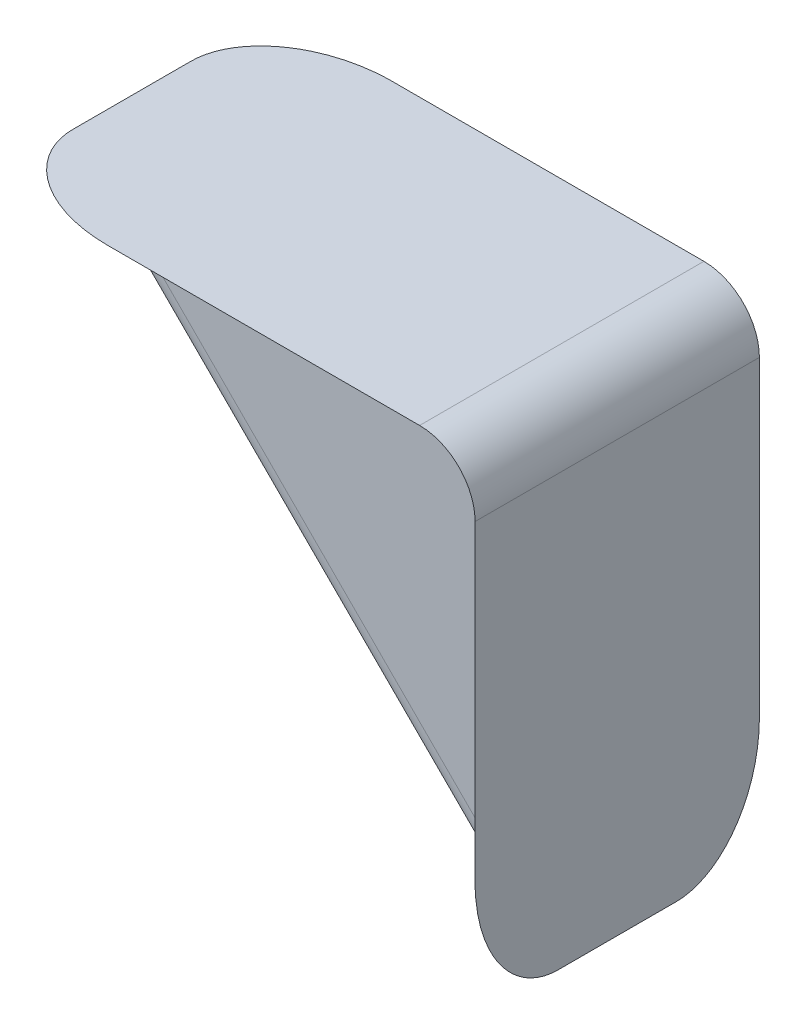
SolidWorks part; units mm, degrees
ref_plane "Plane1" through (0, 0, 0) normal (0, 0, 1) x (1, 0, 0)
ref_plane "Plane2" through (0, 0, 0) normal (0, 1, 0) x (1, 0, 0)
ref_plane "Plane3" through (0, 0, 0) normal (1, 0, 0) x (0, 0, -1)
sketch "Sketch1" plane through (0, 0, 0) normal (0, 0, 1) x (1, 0, 0)
  line L0 (-25.4, 0) -> (0, -25.4)
  line L1 (0, 0) -> (-25.4, 0)
  line L2 (0, 0) -> (0, -25.4)
  dimension "D1" = 25.4
  dimension "D2" = 45
extrude "Extrude1" add sketch "Sketch1" along normal mid plane 9.525
sketch "Sketch2" plane through (0, 0, 0) normal (0, 0, 1) x (1, 0, 0)
  line L0 (0, -25.4) -> (0, 0) construction
  line L1 (0, 0) -> (-25.4, 0) construction
  line L2 (0, -33.6549) -> (0, 0)
  line L3 (0, 0) -> (-33.0172, 0)
extrude "Extrude-Thin1" add sketch "Sketch2" along normal mid plane 26.924 thin
fillet "Fillet1" radius 1.524 2 edges at (-12.7, -12.7, -4.7625) (-12.7, -12.7, 4.7625)
fillet "Fillet2" radius 3.048 12 edges at (-0.8927, -0.8927, 4.7625) (0, -13.1464, 4.7625) (0, -24.7687, 4.3161) (0, -25.4, 0) (0, -24.7687, -4.3161) (0, -13.1464, -4.7625) (-0.8927, -0.8927, -4.7625) (-13.1464, 0, -4.7625) (-24.7687, 0, -4.3161) (-25.4, 0, 0) (-24.7687, 0, 4.3161) (-13.1464, 0, 4.7625)
sketch "Sketch3" plane through (0, 0, 13.462) normal (0, 0, 1) x (1, 0, 0)
  line L6 (-3.048, 2.54) -> (-33.0172, 2.54)
  line L7 (-33.0172, 2.54) -> (-33.0172, 0)
  line L8 (-33.0172, 0) -> (-3.048, 0)
  line L9 (0, -3.048) -> (0, -33.6549)
  line L10 (0, -33.6549) -> (2.54, -33.6549)
  line L11 (2.54, -33.6549) -> (2.54, -3.048)
  line L12 (-3.048, 2.54) -> (-33.0172, 2.54)
  line L13 (-33.0172, 2.54) -> (-33.0172, 0)
  line L14 (-33.0172, 0) -> (-3.048, 0)
  line L15 (0, -3.048) -> (0, -33.6549)
  line L16 (0, -33.6549) -> (2.54, -33.6549)
  line L17 (2.54, -33.6549) -> (2.54, -3.048)
  arc A2 (0, -3.048) -> (-3.048, 0) centre (-3.048, -3.048) ccw
  arc A3 (2.54, -3.048) -> (-3.048, 2.54) centre (-3.048, -3.048) ccw
  arc A4 (0, -3.048) -> (-3.048, 0) centre (-3.048, -3.048) ccw
  arc A5 (2.54, -3.048) -> (-3.048, 2.54) centre (-3.048, -3.048) ccw
  dimension "D1" = 0
extrude "Extrude2" cut sketch "Sketch3" against normal through all
sketch "Orientation Sketch" plane through (0, 0, 0) normal (0, 1, 0) x (1, 0, 0)
  line L4 (-3.048, 7.8105) -> (-20.1967, 7.8105) construction
  line L5 (-26.6625, 3.2385) -> (-26.6625, -3.2385) construction
  line L6 (-20.1967, -7.8105) -> (-3.048, -7.8105) construction
  line L7 (-3.048, 7.8105) -> (-3.048, -7.8105) construction
  line L8 (-3.048, 7.8105) -> (-20.1967, 7.8105)
  line L9 (-26.6625, 3.2385) -> (-26.6625, -3.2385)
  line L10 (-20.1967, -7.8105) -> (-3.048, -7.8105)
  line L11 (-3.048, 7.8105) -> (-3.048, -7.8105)
  ellipse E2 centre (-20.1967, 3.2385) end of major axis (-26.6625, 3.2385) minor radius 4.572 (-20.1967, 7.8105) -> (-26.6625, 3.2385) ccw construction
  ellipse E3 centre (-20.1967, -3.2385) end of major axis (-13.731, -3.2385) minor radius 4.572 (-26.6625, -3.2385) -> (-20.1967, -7.8105) ccw construction
  ellipse E4 centre (-20.1967, 3.2385) end of major axis (-26.6625, 3.2385) minor radius 4.572 (-20.1967, 7.8105) -> (-26.6625, 3.2385) ccw
  ellipse E5 centre (-20.1967, -3.2385) end of major axis (-13.731, -3.2385) minor radius 4.572 (-26.6625, -3.2385) -> (-20.1967, -7.8105) ccw
other "FormTool1"
